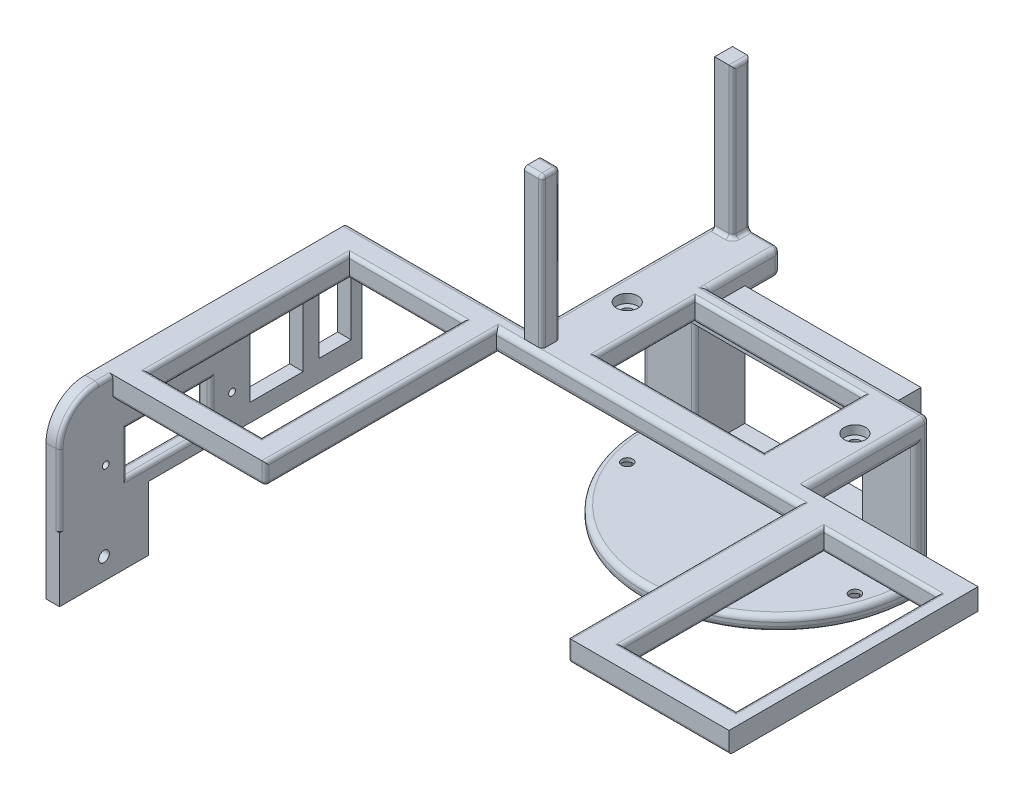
SolidWorks part; units mm, degrees
ref_plane "前视基准面" through (0, 0, 0) normal (0, 0, 1) x (1, 0, 0)
ref_plane "上视基准面" through (0, 0, 0) normal (0, 1, 0) x (1, 0, 0)
ref_plane "右视基准面" through (0, 0, 0) normal (1, 0, 0) x (0, 0, -1)
sketch "草图3" plane through (0, 0, 0) normal (0, 1, 0) x (1, 0, 0)
  line L0 (36.8238, 24.0591) -> (72.2429, 24.0591)
  line L3 (-66.4381, 24.0591) -> (-40.1762, 24.0591)
  line L5 (-95.8571, -60.9409) -> (-87.8571, -60.9409)
  line L6 (-87.8571, -60.9409) -> (-87.8571, -45.9409)
  line L9 (-66.4381, 24.0591) -> (-95.8571, 24.0591)
  line L11 (-95.8571, 24.0591) -> (-95.8571, -60.9409)
  line L12 (-40.1762, 24.0591) -> (-40.1762, 59.0591)
  line L13 (-95.8571, 24.0591) -> (-79.9112, 24.0591)
  line L14 (-95.8571, 24.0591) -> (-95.8571, -60.9409)
  line L17 (72.2429, 24.0591) -> (85.3569, 24.0591)
  line L25 (-40.1762, 59.0591) -> (36.8238, 59.0591)
  line L26 (36.8238, 59.0591) -> (36.8238, 24.0591)
  line L27 (85.3569, 24.0591) -> (85.3569, -45.9409)
  line L28 (85.3569, -45.9409) -> (-87.8571, -45.9409)
  line L30 (-95.8571, 24.0591) -> (85.3569, 24.0591)
  line L31 (-95.8571, 24.0591) -> (-95.8571, -45.9409)
  line L32 (-95.8571, -45.9409) -> (85.3569, -45.9409)
  line L33 (85.3569, 24.0591) -> (85.3569, -45.9409)
  line L34 (-40.1762, 59.0591) -> (36.8238, 59.0591)
  line L35 (-40.1762, 59.0591) -> (-40.1762, 24.0591)
  line L36 (-40.1762, 24.0591) -> (36.8238, 24.0591)
  line L37 (36.8238, 59.0591) -> (36.8238, 24.0591)
  line L38 (-95.8571, -45.9409) -> (-87.8571, -45.9409)
  line L39 (-95.8571, -45.9409) -> (-95.8571, -60.9409)
  line L40 (-95.8571, -60.9409) -> (-87.8571, -60.9409)
  line L41 (-87.8571, -45.9409) -> (-87.8571, -60.9409)
  dimension "D1" = 85
  dimension "D8" = 8
  dimension "D2" = 35
  dimension "D3" = 55.6809
  dimension "D4" = 95.8571
  dimension "D5" = 24.0591
  dimension "D6" = 77
  dimension "D7" = 181.214
  dimension "D10" = 70
extrude "凸台-拉伸1" add sketch "草图3" along normal blind 7.5 contours L9 L3 L12 L25 L26 L0 L17 L27 L28 L6 L5 L11
sketch "草图4" plane through (0, 0, 0) normal (0, -1, 0) x (1, 0, 0)
  line L1 (-95.8571, 60.9409) -> (-87.8571, 60.9409)
  line L2 (-95.8571, 60.9409) -> (-95.8571, -14.0591)
  line L3 (-95.8571, -14.0591) -> (-87.8571, -14.0591)
  line L4 (-87.8571, 60.9409) -> (-87.8571, -14.0591)
  line L6 (-95.8571, -24.0591) -> (-95.8571, 60.9409) construction
  line L7 (-95.8571, 60.9409) -> (-87.8571, 60.9409) construction
  dimension "D1" = 8
  dimension "D2" = 0
  dimension "D3" = 75
  dimension "D4" = 0
extrude "凸台-拉伸2" add sketch "草图4" along normal blind 25
sketch "草图8" plane through (0, 7.5, 0) normal (0, 1, 0) x (1, 0, 0)
  circle A0 centre (0, 0) radius 4.4
extrude "切除-拉伸2" cut sketch "草图8" against normal blind 1 contours A0
sketch "草图9" plane through (0, 6.5, 0) normal (0, 1, 0) x (1, 0, 0)
  circle A0 centre (0, 0) radius 3.4
extrude "切除-拉伸3" cut sketch "草图9" against normal blind 8
sketch "草图15" plane through (0, 0, 0) normal (0, -1, 0) x (1, 0, 0)
  circle A2 centre (-17, 0) radius 2
extrude "凸台-拉伸3" add sketch "草图15" along normal blind 2.5
sketch "草图16" plane through (0, 7.5, 0) normal (0, 1, 0) x (1, 0, 0)
  line L1 (-8, -8) -> (8, -8)
  line L2 (-8, -8) -> (-8, 8)
  line L3 (-8, 8) -> (8, 8)
  line L4 (8, -8) -> (8, 8)
  line L5 (-8, -8) -> (8, 8) construction
  line L6 (-8, 8) -> (8, -8) construction
  point P0 (0, 0)
  dimension "D1" = 16
  dimension "D2" = 16
sketch "草图17" plane through (0, 7.5, 0) normal (0, 1, 0) x (1, 0, 0)
  circle A0 centre (8, 8) radius 2.05
  circle A1 centre (-8, 8) radius 2.05
  circle A2 centre (-8, -8) radius 2.05
  circle A3 centre (8, -8) radius 2.05
  circle A4 centre (-8, 8) radius 3
  circle A5 centre (8, 8) radius 3
  circle A6 centre (-8, -8) radius 3
  circle A7 centre (8, -8) radius 3
sketch "草图18" plane through (0, 7.5, 0) normal (0, 1, 0) x (1, 0, 0)
  circle A0 centre (0, 0) radius 4.4
  circle A1 centre (0, 0) radius 5.4
sketch "草图19" plane through (0, 7.5, 0) normal (0, 1, 0) x (1, 0, 0)
  circle A0 centre (35.3025, 0) radius 2
extrude "切除-拉伸7" cut sketch "草图19" against normal blind 6
sketch "草图20" plane through (0, 7.5, 0) normal (0, 1, 0) x (1, 0, 0)
  line L1 (-7.5, -12) -> (7.5, -12)
  line L2 (-7.5, -12) -> (-7.5, -20)
  line L3 (-7.5, -20) -> (7.5, -20)
  line L4 (7.5, -12) -> (7.5, -20)
  line L5 (-7.5, -12) -> (7.5, -20) construction
  line L6 (-7.5, -20) -> (7.5, -12) construction
  point P0 (0, -16)
  dimension "D1" = 15
  dimension "D2" = 8
  dimension "D3" = 0
sketch "草图26" plane through (-95.8571, 0, 0) normal (-1, 0, 0) x (0, 0, 1)
  line L0 (-24.0591, 7.5) -> (-24.0591, 0) construction
  line L1 (-24.0591, 7.5) -> (60.9409, 7.5)
  line L2 (-24.0591, 7.5) -> (-24.0591, -20)
  line L3 (-24.0591, -20) -> (60.9409, -20)
  line L4 (60.9409, 7.5) -> (60.9409, -20)
  line L6 (60.9409, 7.5) -> (60.9409, -25) construction
  dimension "D1" = 0
  dimension "D2" = 0
extrude "凸台-拉伸10" add sketch "草图26" along normal blind 18
sketch "草图28" plane through (0, 0, -24.0591) normal (0, 0, -1) x (-1, 0, 0)
  line L0 (113.8571, 7.5) -> (40.1762, 7.5) construction
  line L1 (95.3571, 7.5) -> (112.3571, 7.5)
  line L2 (95.3571, 7.5) -> (95.3571, -25)
  line L3 (95.3571, -25) -> (112.3571, -25)
  line L4 (112.3571, 7.5) -> (112.3571, -25)
  line L5 (95.8571, -25) -> (87.8571, -25) construction
  line L6 (113.8571, 7.5) -> (113.8571, -20) construction
  dimension "D1" = 17
  dimension "D2" = 1.5
extrude "切除-拉伸10" cut sketch "草图28" against normal blind 55
sketch "草图29" plane through (-113.8571, 0, 0) normal (-1, 0, 0) x (0, 0, 1)
  line L0 (60.9409, -20) -> (60.9409, 7.5) construction
  line L1 (60.9409, 7.5) -> (-24.0591, 7.5) construction
  circle A0 centre (30.9409, -4.5) radius 8
  dimension "D1" = 30
  dimension "D2" = 12
extrude "切除-拉伸11" cut sketch "草图29" against normal blind 3
sketch "草图42" plane through (0, 7.5, 0) normal (0, 1, 0) x (1, 0, 0)
  line L1 (-38.1758, -44.809) -> (34.0165, -44.809)
  line L2 (-38.1758, -44.809) -> (-38.1758, -20.5182)
  line L3 (-38.1758, -20.5182) -> (34.0165, -20.5182)
  line L4 (34.0165, -44.809) -> (34.0165, -20.5182)
sketch "草图43" plane through (-95.3571, 0, 0) normal (-1, 0, 0) x (0, 0, 1)
  line L0 (-24.0591, -20) -> (60.9409, -20) construction
  line L1 (-24.0591, 7.5) -> (-21.0591, 7.5)
  line L2 (-24.0591, 7.5) -> (-24.0591, -20)
  line L3 (-24.0591, -20) -> (-21.0591, -20)
  line L4 (-21.0591, 7.5) -> (-21.0591, -20)
  line L5 (-24.0591, 7.5) -> (-24.0591, -20) construction
  dimension "D1" = 3
  dimension "D2" = 0
extrude "凸台-拉伸16" add sketch "草图43" along normal blind 18.5
sketch "草图44" plane through (0, 0, -24.0591) normal (0, 0, -1) x (-1, 0, 0)
  line L1 (-55.9452, 6.5) -> (-40.9452, 6.5)
  line L2 (-55.9452, 6.5) -> (-55.9452, 1)
  line L3 (-55.9452, 1) -> (-40.9452, 1)
  line L4 (-40.9452, 6.5) -> (-40.9452, 1)
  line L5 (-86.3668, 1) -> (-31.0548, 1) construction
  line L7 (-30.9452, 6.5) -> (-30.9452, 1) construction
  dimension "D1" = 10
  dimension "D2" = 15
extrude "凸台-拉伸17" add sketch "草图44" along normal blind 120
sketch "草图45" plane through (55.9452, 0, 0) normal (1, 0, 0) x (0, 0, -1)
  line L0 (144.0591, 6.5) -> (24.0591, 6.5) construction
  line L1 (44, 6.5) -> (94, 6.5)
  line L2 (44, 6.5) -> (44, -18.5)
  line L3 (44, -18.5) -> (94, -18.5)
  line L4 (94, 6.5) -> (94, -18.5)
  line L5 (19, 7.5) -> (19, 0) construction
  dimension "D1" = 50
  dimension "D2" = 25
  dimension "D3" = 25
extrude "凸台-拉伸18" add sketch "草图45" along normal blind 30
sketch "草图46" plane through (0, 0, -44) normal (0, 0, 1) x (1, 0, 0)
  line L0 (85.9452, 6.5) -> (85.9452, -18.5) construction
  line L1 (82.9452, -16.5) -> (57.9452, -16.5)
  line L2 (82.9452, -16.5) -> (82.9452, 4.5)
  line L3 (82.9452, 4.5) -> (57.9452, 4.5)
  line L4 (57.9452, -16.5) -> (57.9452, 4.5)
  line L5 (85.9452, -18.5) -> (55.9452, -18.5) construction
  line L6 (55.9452, 1) -> (55.9452, -18.5) construction
  line L7 (30.5227, 7.5) -> (86.3668, 7.5) construction
  dimension "D1" = 3
  dimension "D2" = 2
  dimension "D3" = 2
  dimension "D4" = 3
extrude "切除-拉伸16" cut sketch "草图46" against normal blind 50
sketch "草图48" plane through (40.9452, 0, 0) normal (-1, 0, 0) x (0, 0, 1)
  line L0 (-144.0591, 6.5) -> (-24.0591, 6.5) construction
  line L1 (-134.0591, 6.5) -> (-106.5591, 6.5)
  line L2 (-134.0591, 6.5) -> (-134.0591, 1)
  line L3 (-134.0591, 1) -> (-106.5591, 1)
  line L4 (-106.5591, 6.5) -> (-106.5591, 1)
  line L5 (-144.0591, 1) -> (-24.0591, 1) construction
  line L6 (-144.0591, 1) -> (-144.0591, 6.5) construction
  dimension "D1" = 27.5
  dimension "D2" = 10
extrude "凸台-拉伸19" add sketch "草图48" along normal blind 1
sketch "草图49" plane through (0, 6.5, 0) normal (0, 1, 0) x (1, 0, 0)
  line L0 (55.9452, 144.0591) -> (55.9452, 94) construction
  line L2 (40.9452, 144.0591) -> (55.9452, 144.0591) construction
  circle A0 centre (48.4452, 138.0591) radius 2.05
  dimension "D1" = 7.5
  dimension "D2" = 6
extrude "切除-拉伸17" cut sketch "草图49" against normal blind 10
sketch "草图50" plane through (0, 1, 0) normal (0, -1, 0) x (1, 0, 0)
  circle A0 centre (48.4452, -138.0591) radius 3.5
extrude "切除-拉伸18" cut sketch "草图50" against normal blind 2.6
fillet "圆角5" radius 1 6 edges at (55.9452, 6.5, -34.0296) (55.9452, 1, -119.0296) (40.9452, 6.5, -65.3091) (39.9452, 1, -120.3091) (55.9452, -18.5, -69) (85.9452, 6.5, -69)
sketch "草图52" plane through (0, 7.5, 0) normal (0, 1, 0) x (1, 0, 0)
  line L0 (-113.8571, 24.0591) -> (-40.1762, 24.0591) construction
  line L1 (-45, -52.9409) -> (40, -52.9409)
  line L2 (-45, -52.9409) -> (-45, 19.0591)
  line L3 (-45, 19.0591) -> (40, 19.0591)
  line L4 (40, -52.9409) -> (40, 19.0591)
  dimension "D1" = 85
  dimension "D2" = 40
  dimension "D3" = 72
  dimension "D4" = 5
extrude "切除-拉伸20" cut sketch "草图52" against normal blind 10
sketch "草图53" plane through (0, 0, 0) normal (0, -1, 0) x (1, 0, 0)
  line L0 (-40.1762, -24.0591) -> (-40.1762, -59.0591) construction
  line L1 (36.8238, -59.0591) -> (-40.1762, -59.0591)
  line L2 (36.8238, -59.0591) -> (36.8238, -55.0591)
  line L3 (36.8238, -55.0591) -> (-40.1762, -55.0591)
  line L4 (-40.1762, -59.0591) -> (-40.1762, -55.0591)
  dimension "D1" = 4
extrude "凸台-拉伸20" add sketch "草图53" along normal blind 37
sketch "草图54" plane through (0, 0, -55.0591) normal (0, 0, 1) x (1, 0, 0)
  line L0 (36.8238, -37) -> (-40.1762, -37) construction
  line L5 (-50.1762, -37) -> (41.0548, -37)
  line L7 (-50.1762, -37) -> (-50.1762, -33)
  line L8 (-50.1762, -33) -> (41.0548, -33)
  line L9 (41.0548, -33) -> (41.0548, -37)
  line L12 (-40.1762, -37) -> (-40.1762, 0) construction
  dimension "D1" = 4
  dimension "D2" = 0
  dimension "D3" = 10
extrude "凸台-拉伸21" add sketch "草图54" along normal blind 40
sketch "草图56" plane through (0, -33, 0) normal (0, 1, 0) x (1, 0, 0)
  line L0 (-40.1762, 59.0591) -> (36.8238, 59.0591) construction
  line L3 (36.8238, 59.0591) -> (36.8238, 24.0591) construction
  circle A0 centre (-20.1762, 44.0591) radius 3.25
  circle A1 centre (-20.1762, 44.0591) radius 1.75
  circle A2 centre (31.8238, 44.0591) radius 3.25
  circle A3 centre (31.8238, 44.0591) radius 1.75
  dimension "D1" = 52
  dimension "D2" = 5
  dimension "D3" = 15
  dimension "D4" = 0
sketch "草图58" plane through (-87.8571, 0, 0) normal (1, 0, 0) x (0, 0, -1)
  line L1 (-60.9409, 7.5) -> (-60.9409, -25) construction
  line L2 (14.0591, -25) -> (-60.9409, -25) construction
  circle A0 centre (-12.4409, -15) radius 0.95
  circle A1 centre (-47.9409, -15) radius 0.95
  dimension "D1" = 35.5
  dimension "D5" = 1.9
  dimension "D6" = 1.9
  dimension "D2" = 13
  dimension "D3" = 10
  dimension "D4" = 10
extrude "切除-拉伸23" cut sketch "草图58" against normal blind 10
sketch "草图59" plane through (0, -25, 0) normal (0, -1, 0) x (1, 0, 0)
  line L1 (-117.5387, 65.8963) -> (-91.6567, 65.8963)
  line L2 (-117.5387, 65.8963) -> (-117.5387, -30.1249)
  line L3 (-117.5387, -30.1249) -> (-91.6567, -30.1249)
  line L4 (-91.6567, 65.8963) -> (-91.6567, -30.1249)
extrude "切除-拉伸24" cut sketch "草图59" against normal blind 50
sketch "草图61" plane through (0, 7.5, 0) normal (0, 1, 0) x (1, 0, 0)
  line L1 (-40.1762, 59.0591) -> (36.8238, 59.0591) construction
  line L3 (-40.1762, 59.0591) -> (36.8238, 59.0591)
  line L4 (-1.6762, 59.0591) -> (-1.6762, 44.0591)
  line L5 (-87.8571, -60.9409) -> (-87.8571, -45.9409) construction
  circle A0 centre (-33.2471, 44.0591) radius 1.55
  circle A1 centre (30.7529, 44.0591) radius 1.55
  dimension "D1" = 64
  dimension "D5" = 3.1
  dimension "D6" = 3.1
  dimension "D2" = 90
  dimension "D3" = 15
  dimension "D4" = 0
  dimension "D7" = 54.61
extrude "切除-拉伸25" cut sketch "草图61" against normal through all
sketch "草图62" plane through (0, 7.5, 0) normal (0, 1, 0) x (1, 0, 0)
  circle A0 centre (-33.2471, 44.0591) radius 3.75
  circle A1 centre (30.7529, 44.0591) radius 3.75
  circle A2 centre (-33.2471, 44.0591) radius 4.75
  circle A3 centre (30.7529, 44.0591) radius 4.75
sketch "草图63" plane through (0, 0, -144.0591) normal (0, 0, -1) x (-1, 0, 0)
  line L1 (-91.8402, 15.9569) -> (-37.358, 15.9569)
  line L2 (-91.8402, 15.9569) -> (-91.8402, -21.0322)
  line L3 (-91.8402, -21.0322) -> (-37.358, -21.0322)
  line L4 (-37.358, 15.9569) -> (-37.358, -21.0322)
extrude "切除-拉伸26" cut sketch "草图63" against normal blind 120
sketch "草图66" plane through (0, 7.5, 0) normal (0, 1, 0) x (1, 0, 0)
  circle A0 centre (-33.2471, 44.0591) radius 3
  circle A1 centre (30.7529, 44.0591) radius 3
  dimension "D1" = 6
  dimension "D2" = 6
extrude "切除-拉伸27" cut sketch "草图66" against normal blind 4
sketch "草图68" plane through (-91.6567, 0, 0) normal (-1, 0, 0) x (0, 0, 1)
  line L0 (-14.0591, -25) -> (60.9409, -25) construction
  line L1 (14.808, -15) -> (13.6244, -12.95)
  line L2 (13.6244, -12.95) -> (11.2573, -12.95)
  line L3 (11.2573, -12.95) -> (10.0737, -15)
  line L4 (10.0737, -15) -> (11.2573, -17.05)
  line L5 (11.2573, -17.05) -> (13.6244, -17.05)
  line L6 (13.6244, -17.05) -> (14.808, -15)
  line L7 (50.308, -15) -> (49.1244, -12.95)
  line L8 (49.1244, -12.95) -> (46.7573, -12.95)
  line L9 (46.7573, -12.95) -> (45.5737, -15)
  line L10 (45.5737, -15) -> (46.7573, -17.05)
  line L11 (46.7573, -17.05) -> (49.1244, -17.05)
  line L12 (49.1244, -17.05) -> (50.308, -15)
  circle A0 centre (12.4409, -15) radius 2.05 construction
  circle A1 centre (47.9409, -15) radius 2.05 construction
  point P10 (47.9409, -17.05)
  dimension "D1" = 4.1
  dimension "D2" = 4.1
extrude "切除-拉伸29" cut sketch "草图68" against normal blind 2
sketch "草图70" plane through (0, -37, 0) normal (0, -1, 0) x (1, 0, 0)
  line L0 (-40.1762, -59.0591) -> (36.8238, -59.0591) construction
  line L1 (-29.5521, -44.0591) -> (-31.3996, -40.8591)
  line L2 (-31.3996, -40.8591) -> (-35.0947, -40.8591)
  line L3 (-35.0947, -40.8591) -> (-36.9422, -44.0591)
  line L4 (-36.9422, -44.0591) -> (-35.0947, -47.2591)
  line L5 (-35.0947, -47.2591) -> (-31.3996, -47.2591)
  line L6 (-31.3996, -47.2591) -> (-29.5521, -44.0591)
  line L7 (34.4479, -44.0591) -> (32.6004, -40.8591)
  line L8 (32.6004, -40.8591) -> (28.9053, -40.8591)
  line L9 (28.9053, -40.8591) -> (27.0578, -44.0591)
  line L10 (27.0578, -44.0591) -> (28.9053, -47.2591)
  line L11 (28.9053, -47.2591) -> (32.6004, -47.2591)
  line L12 (32.6004, -47.2591) -> (34.4479, -44.0591)
  circle A0 centre (-33.2471, -44.0591) radius 3.2 construction
  circle A1 centre (30.7529, -44.0591) radius 3.2 construction
  point P10 (30.7529, -40.8591)
  dimension "D1" = 6.4
  dimension "D2" = 6.4
extrude "切除-拉伸31" cut sketch "草图70" against normal blind 3
sketch "草图71" plane through (0, -33, 0) normal (0, 1, 0) x (1, 0, 0)
  line L0 (-40.1762, 55.0591) -> (36.8238, 55.0591)
  line L2 (-50.1762, 55.0591) -> (41.0548, 55.0591)
  line L3 (-50.1762, 55.0591) -> (-50.1762, 15.0591)
  line L4 (-50.1762, 15.0591) -> (41.0548, 15.0591)
  line L5 (41.0548, 55.0591) -> (41.0548, 15.0591)
  circle A1 centre (-1.6762, 55.0591) radius 38.5
extrude "切除-拉伸32" cut sketch "草图71" against normal through all
sketch "草图72" plane through (0, 7.5, 0) normal (0, 1, 0) x (1, 0, 0)
  line L1 (-91.6567, 24.0591) -> (85.3569, 24.0591)
  line L2 (-91.6567, 24.0591) -> (-91.6567, -45.9409)
  line L3 (-91.6567, -45.9409) -> (85.3569, -45.9409)
  line L4 (85.3569, 24.0591) -> (85.3569, -45.9409)
  line L5 (-40.1762, 59.0591) -> (36.8238, 59.0591)
  line L6 (-40.1762, 59.0591) -> (-40.1762, 24.0591)
  line L7 (-40.1762, 24.0591) -> (36.8238, 24.0591)
  line L8 (36.8238, 59.0591) -> (36.8238, 24.0591)
  line L9 (-91.6567, -45.9409) -> (-87.8571, -45.9409)
  line L10 (-91.6567, -45.9409) -> (-91.6567, -60.9409)
  line L11 (-91.6567, -60.9409) -> (-87.8571, -60.9409)
  line L12 (-87.8571, -45.9409) -> (-87.8571, -60.9409)
extrude "切除-拉伸33" cut sketch "草图72" against normal blind 1.5 contours L1 M19 M17 M18 M6 M5 | L3 L1 M7 M10 M11 M12 M13 M14 M15 M16 M20 | L3 M7 M8 M9
fillet "圆角8" radius 11 1 edges at (-89.7569, 6, 60.9409)
sketch "草图74" plane through (0, -37, 0) normal (0, -1, 0) x (1, 0, 0)
  line L0 (-40.1762, -55.0591) -> (36.8238, -55.0591)
  line L2 (-40.1762, -55.0591) -> (36.8238, -55.0591)
  line L3 (-40.1762, -55.0591) -> (-40.1762, -59.0591)
  line L4 (-40.1762, -59.0591) -> (36.8238, -59.0591)
  line L5 (36.8238, -55.0591) -> (36.8238, -59.0591)
  circle A0 centre (-1.6762, -55.0591) radius 32.5
extrude "切除-拉伸35" cut sketch "草图74" against normal blind 0.0001 contours A0 M15 M16 | L4 A0 L0 | A0 M16 M13 | L0 M14 M12 M7 M8 M9 M10 M11 M6 M1 M2 M3 M4 M5
fillet "圆角10" radius 1.5 12 edges at (36.8238, 0, -39.5591) (-1.6762, -33, -16.5591) (-40.1762, -15.4999, -59.0591) (36.8238, -15.4999, -59.0591) (-40.1762, 6, -41.5591) (-1.6762, 6, -59.0591) (36.8238, 6, -41.5591) (-1.6762, -36.9999, -59.0591) (-40.1762, -36.9999, -57.0591) (-1.6762, -36.9999, -16.5591) (33.5241, -36.9999, -42.4591) (36.8238, -36.9999, -57.0591)
fillet "圆角11" radius 1.5 2 edges at (-40.1762, -17.25, -55.0591) (36.8238, -16.5, -55.0591)
fillet "圆角12" radius 1.5 2 edges at (-2.5, 0, -19.0591) (-2.5, 6, -19.0591)
fillet "圆角13" radius 1 3 edges at (-87.8571, 6, 47.9409) (-87.8571, 2.7782, 57.719) (-87.8571, -15, 60.9409)
sketch "草图75" plane through (0, 6, 0) normal (0, 1, 0) x (1, 0, 0)
  line L0 (-33.2471, 44.0591) -> (30.7878, 44.0591)
  line L1 (-1.2297, 44.0591) -> (-1.2297, 14.9543) construction
  line L2 (-40.1762, 24.0591) -> (36.8238, 24.0591)
  line L3 (-38.6762, 59.0591) -> (35.3238, 59.0591) construction
  line L4 (22.2703, 54.5591) -> (-24.7297, 54.5591)
  line L5 (22.2703, 54.5591) -> (22.2703, 24.0591)
  line L6 (22.2703, 24.0591) -> (-24.7297, 24.0591)
  line L7 (-24.7297, 54.5591) -> (-24.7297, 24.0591)
  line L8 (22.2703, 54.5591) -> (-24.7297, 24.0591) construction
  line L9 (22.2703, 24.0591) -> (-24.7297, 54.5591) construction
  line L12 (-24.7297, 54.5591) -> (22.2703, 54.5591)
  line L13 (-24.7297, 54.5591) -> (-24.7297, 27.0591)
  line L14 (-24.7297, 27.0591) -> (22.2703, 27.0591)
  line L15 (22.2703, 54.5591) -> (22.2703, 27.0591)
  point P7 (-1.2297, 39.3091)
  dimension "D1" = 64.0349
  dimension "D2" = 4.5
  dimension "D3" = 47
  dimension "D4" = 3
extrude "切除-拉伸36" cut sketch "草图75" against normal blind 13 contours L0 L7 L2 L5 | L4 L7 L0 L5
sketch "草图76" plane through (0, 0, -59.0591) normal (0, 0, -1) x (-1, 0, 0)
  line L0 (-35.3238, -36.9999) -> (38.6762, -36.9999)
  line L1 (1.6762, -36.9999) -> (1.6762, 4.5) construction
  line L2 (38.6762, 4.5) -> (-35.3238, 4.5) construction
  line L3 (-35.3238, 6) -> (38.6762, 6) construction
  line L4 (25.1762, -1) -> (-21.8238, -1)
  line L5 (25.1762, -1) -> (25.1762, -31.9999)
  line L6 (25.1762, -31.9999) -> (-21.8238, -31.9999)
  line L7 (-21.8238, -1) -> (-21.8238, -31.9999)
  line L8 (25.1762, -1) -> (-21.8238, -31.9999) construction
  line L9 (25.1762, -31.9999) -> (-21.8238, -1) construction
  point P8 (1.6762, -16.5)
  dimension "D1" = 5
  dimension "D2" = 47
  dimension "D3" = 7
extrude "切除-拉伸37" cut sketch "草图76" against normal blind 13 contours L4 L7 L6 L5
sketch "草图77" plane through (0, 6, 0) normal (0, 1, 0) x (1, 0, 0)
  line L0 (-87.8571, -45.8551) -> (-87.8571, 22.5591) construction
  line L1 (-38.6762, 22.5591) -> (-91.6567, 22.5591) construction
  line L2 (-44, 19.0591) -> (-87.8571, 19.0591) construction
  line L3 (-87.8571, 19.0591) -> (85.3569, 19.0591) construction
  line L4 (-83.8571, 16.5591) -> (-52, 16.5591)
  line L5 (-83.8571, 16.5591) -> (-83.8571, -39.9409)
  line L6 (-83.8571, -39.9409) -> (-52, -39.9409)
  line L7 (-52, 16.5591) -> (-52, -39.9409)
  line L8 (85.3569, -45.9409) -> (85.3569, 24.0591) construction
  line L9 (-1.2501, 19.0591) -> (-1.2501, -30.1333)
  line L10 (81.3569, -39.9409) -> (49.4997, -39.9409)
  line L11 (49.4997, 16.5591) -> (49.4997, -39.9409)
  line L12 (81.3569, 16.5591) -> (49.4997, 16.5591)
  line L13 (81.3569, 16.5591) -> (81.3569, -39.9409)
  line L14 (-46.5, -45.9409) -> (-87.8571, -45.9409) construction
  line L15 (-87.8571, -45.9409) -> (-87.8571, -49.9409) construction
  line L16 (-45, 13.0591) -> (-45, -44.4409) construction
  dimension "D1" = 5
  dimension "D2" = 6
  dimension "D3" = 4
  dimension "D4" = 7
extrude "切除-拉伸38" cut sketch "草图77" against normal blind 13 contours L7 L4 L5 L6 | L13 L12 L11 L10
sketch "草图78" plane through (-91.6567, 0, 0) normal (-1, 0, 0) x (0, 0, 1)
  line L0 (12.4409, -15) -> (47.9409, -15)
  line L1 (59.9409, -25) -> (-13.0591, -25) construction
  line L2 (41.9409, -21) -> (18.4409, -21)
  line L3 (41.9409, -21) -> (41.9409, -9)
  line L4 (41.9409, -9) -> (18.4409, -9)
  line L5 (18.4409, -21) -> (18.4409, -9)
  line L6 (41.9409, -21) -> (18.4409, -9) construction
  line L7 (41.9409, -9) -> (18.4409, -21) construction
  point P4 (30.1909, -15)
  dimension "D1" = 6
  dimension "D2" = 4
extrude "切除-拉伸39" cut sketch "草图78" against normal through all
sketch "草图79" plane through (-91.6567, 0, 0) normal (-1, 0, 0) x (0, 0, 1)
  line L0 (18.4409, -21) -> (18.4409, -9) construction
  line L1 (7.4409, -20) -> (-7.5591, -20)
  line L2 (7.4409, -20) -> (7.4409, 0)
  line L3 (7.4409, 0) -> (-7.5591, 0)
  line L4 (-7.5591, -20) -> (-7.5591, 0)
  line L5 (59.9409, -25) -> (-13.0591, -25) construction
  line L6 (-22.5591, 6) -> (49.9409, 6) construction
  dimension "D1" = 11
  dimension "D2" = 5
  dimension "D3" = 6
  dimension "D4" = 15
extrude "切除-拉伸40" cut sketch "草图79" against normal through all contours L2 L1 L4 L3
fillet "圆角14" radius 1 8 edges at (-91.6567, -21, 30.1909) (-91.6567, -15, 41.9409) (-91.6567, -9, 30.1909) (-91.6567, -15, 18.4409) (-87.8571, -15, 41.9409) (-87.8571, -9, 30.1909) (-87.8571, -15, 18.4409) (-87.8571, -21, 30.1909)
fillet "圆角15" radius 1 24 edges at (-1.2297, 6, -54.5591) (-1.2297, 0, -54.5591) (-24.7297, 6, -40.8091) (-24.7297, 0, -40.8091) (-1.2297, 6, -27.0591) (-1.2297, 0, -27.0591) (22.2703, 0, -40.8091) (22.2703, 6, -40.8091) (-67.9286, 0, -16.5591) (-67.9286, 6, -16.5591) (-52, 0, 11.6909) (-52, 6, 11.6909) (-83.8571, 6, 11.6909) (-83.8571, 0, 11.6909) (-67.9286, 6, 39.9409) (-67.9286, 0, 39.9409) (65.4283, 6, -16.5591) (65.4283, 0, -16.5591) (49.4997, 6, 11.6909) (49.4997, 0, 11.6909) (65.4283, 0, 39.9409) (65.4283, 6, 39.9409) (81.3569, 0, 11.6909) (81.3569, 6, 11.6909)
fillet "圆角16" radius 1 1 edges at (-25.1762, -16.4999, -55.0591)
sketch "草图80" plane through (0, 6, 0) normal (0, 1, 0) x (1, 0, 0)
  line L1 (-33.6762, 25.5591) -> (-38.6762, 25.5591)
  line L2 (-33.6762, 25.5591) -> (-33.6762, 20.5591)
  line L3 (-33.6762, 20.5591) -> (-38.6762, 20.5591)
  line L4 (-38.6762, 25.5591) -> (-38.6762, 20.5591)
  line L5 (-45, 20.5591) -> (40, 20.5591) construction
  line L6 (-38.6762, 57.5591) -> (-38.6762, 22.5591) construction
  dimension "D1" = 5
  dimension "D2" = 5
extrude "凸台-拉伸22" add sketch "草图80" along normal blind 42
sketch "草图81" plane through (0, 6, 0) normal (0, 1, 0) x (1, 0, 0)
  line L1 (-38.6762, 57.5591) -> (-31.6762, 57.5591)
  line L2 (-38.6762, 57.5591) -> (-38.6762, 50.5591)
  line L3 (-38.6762, 50.5591) -> (-31.6762, 50.5591)
  line L4 (-31.6762, 57.5591) -> (-31.6762, 50.5591)
  dimension "D1" = 7
  dimension "D2" = 7
sketch "草图82" plane through (0, 0, -59.0591) normal (0, 0, -1) x (-1, 0, 0)
  line L0 (38.6762, 6) -> (91.6567, 6) construction
  line L1 (25.1762, -1) -> (40.1762, -1)
  line L2 (25.1762, -1) -> (25.1762, 6)
  line L3 (25.1762, 6) -> (40.1762, 6)
  line L4 (40.1762, -1) -> (40.1762, 6)
  line L5 (40.1762, 4.5) -> (40.1762, -35.4999) construction
extrude "凸台-拉伸24" add sketch "草图82" along normal blind 20
sketch "草图83" plane through (0, 6, 0) normal (0, 1, 0) x (1, 0, 0)
  line L0 (-40.1762, 79.0591) -> (-25.1762, 79.0591) construction
  line L1 (-33.6762, 79.0591) -> (-38.6762, 79.0591)
  line L2 (-33.6762, 79.0591) -> (-33.6762, 74.0591)
  line L3 (-33.6762, 74.0591) -> (-38.6762, 74.0591)
  line L4 (-38.6762, 79.0591) -> (-38.6762, 74.0591)
  line L5 (-38.6762, 81.8229) -> (-38.6762, 17.7922) construction
  dimension "D1" = 5
  dimension "D2" = 5
extrude "凸台-拉伸25" add sketch "草图83" along normal blind 42
fillet "圆角18" radius 1.5 7 edges at (-40.1762, 2.5, -79.0591) (-25.1762, 2.5, -79.0591) (-25.1762, -1, -69.0591) (-32.6762, -1, -79.0591) (-40.1762, -1, -69.0591) (-25.1762, 6, -69.0591) (-40.1762, 6, -69.0591)
sketch "草图84" plane through (-40.1762, 0, 0) normal (-1, 0, 0) x (0, 0, 1)
  line L0 (-57.5591, 4.5) -> (-57.5591, -35.4999) construction
  line L1 (-59.0591, 6) -> (-57.5591, 6)
  line L2 (-59.0591, 6) -> (-59.0591, -1)
  line L3 (-59.0591, -1) -> (-57.5591, -1)
  line L4 (-57.5591, 6) -> (-57.5591, -1)
extrude "凸台-拉伸26" add sketch "草图84" against normal blind 15
fillet "圆角19" radius 1.5 3 edges at (-40.1762, -1, -58.3091) (-25.1762, 6, -58.3091) (-40.1762, 6, -58.3091)
fillet "圆角20" radius 1 12 edges at (-25.6155, 5.5607, -78.6198) (-36.1762, 6, -74.0591) (-30.1762, 6, -79.0591) (-33.6762, 48, -76.5591) (-33.6762, 6, -76.5591) (-36.1762, 48, -20.5591) (-33.6762, 48, -23.0591) (-36.1762, 48, -25.5591) (-33.6762, 27, -74.0591) (-33.6762, 27, -79.0591) (-33.6762, 27, -20.5591) (-33.6762, 27, -25.5591)
fillet "圆角22" radius 1 8 edges at (-45, 3, 45.9409) (-45, 6, 12.6909) (-45, 0, 12.6909) (40, 3, 45.9409) (40, 6, 12.6909) (40, 0, 12.6909) (62.6784, 0, 45.9409) (-66.4286, 0, 45.9409)
sketch "草图86" plane through (0, -25, 0) normal (0, -1, 0) x (1, 0, 0)
  line L0 (-87.8571, -14.0591) -> (-87.8571, 59.9409) construction
  line L1 (-91.6567, 60.9409) -> (-87.8571, 60.9409)
  line L2 (-91.6567, 60.9409) -> (-91.6567, 35.9409)
  line L3 (-91.6567, 35.9409) -> (-87.8571, 35.9409)
  line L4 (-87.8571, 60.9409) -> (-87.8571, 35.9409)
  dimension "D1" = 25
extrude "凸台-拉伸27" add sketch "草图86" along normal blind 18
sketch "草图87" plane through (-91.6567, 0, 0) normal (-1, 0, 0) x (0, 0, 1)
  line L1 (35.9409, -25) -> (60.9409, -25)
  line L2 (35.9409, -25) -> (35.9409, -43)
  line L3 (35.9409, -43) -> (60.9409, -43)
  line L4 (60.9409, -25) -> (60.9409, -43)
  circle A0 centre (48.4409, -37) radius 1.5
  dimension "D1" = 3
  dimension "D2" = 12
  dimension "D3" = 12.5
extrude "切除-拉伸41" cut sketch "草图87" against normal through all contours A0
sketch "草图89" plane through (0, 0, -14.0591) normal (0, 0, -1) x (-1, 0, 0)
  line L0 (91.6567, -25) -> (91.6567, 0) construction
  line L1 (87.8571, -25) -> (91.6567, -25)
  line L2 (87.8571, -25) -> (87.8571, -19)
  line L3 (87.8571, -19) -> (91.6567, -19)
  line L4 (91.6567, -25) -> (91.6567, -19)
  dimension "D1" = 6
extrude "凸台-拉伸28" add sketch "草图89" along normal blind 10
sketch "草图90" plane through (0, -19, 0) normal (0, 1, 0) x (1, 0, 0)
  line L0 (-91.6567, 24.0591) -> (-91.6567, 14.0591) construction
  line L1 (-87.8571, 24.0591) -> (-91.6567, 24.0591)
  line L2 (-87.8571, 24.0591) -> (-87.8571, 21.0591)
  line L3 (-87.8571, 21.0591) -> (-91.6567, 21.0591)
  line L4 (-91.6567, 24.0591) -> (-91.6567, 21.0591)
  dimension "D1" = 3
extrude "凸台-拉伸29" add sketch "草图90" along normal blind 21
sketch "草图91" plane through (0, 0, -14.0591) normal (0, 0, -1) x (-1, 0, 0)
  line L1 (87.8571, 0) -> (91.6567, 0)
  line L2 (87.8571, 0) -> (87.8571, -19)
  line L3 (87.8571, -19) -> (91.6567, -19)
  line L4 (91.6567, 0) -> (91.6567, -19)
extrude "切除-拉伸42" cut sketch "草图91" against normal blind 2
sketch "草图92" plane through (0, 0, -59.0591) normal (0, 0, -1) x (-1, 0, 0)
  line L0 (1.6762, -1) -> (1.6762, -31.9999)
  line L13 (25.1762, -1) -> (-21.8238, -1) construction
  line L14 (25.1762, -31.9999) -> (-21.8238, -31.9999) construction
  line L15 (-21.8238, -16.5) -> (25.1762, -16.4999)
  line L16 (-21.8238, -1) -> (-21.8238, -31.9999) construction
  line L17 (25.1762, -1) -> (25.1762, -31.9999) construction
  line L19 (-24.3238, -34.4999) -> (27.6762, -34.4999)
  line L20 (-24.3238, -34.4999) -> (-24.3238, 1.5001)
  line L21 (-24.3238, 1.5001) -> (27.6762, 1.5001)
  line L22 (27.6762, -34.4999) -> (27.6762, 1.5001)
  line L23 (-24.3238, -34.4999) -> (27.6762, 1.5001) construction
  line L24 (-24.3238, 1.5001) -> (27.6762, -34.4999) construction
  point P4 (1.6762, -16.4999)
  dimension "D1" = 36
  dimension "D2" = 52
extrude "凸台-拉伸30" add sketch "草图92" along normal blind 10 contours L19 L22 L21 L20 M13 M14 M15 M23 M20 M21 M22
equation "\"1。。\"=10"
